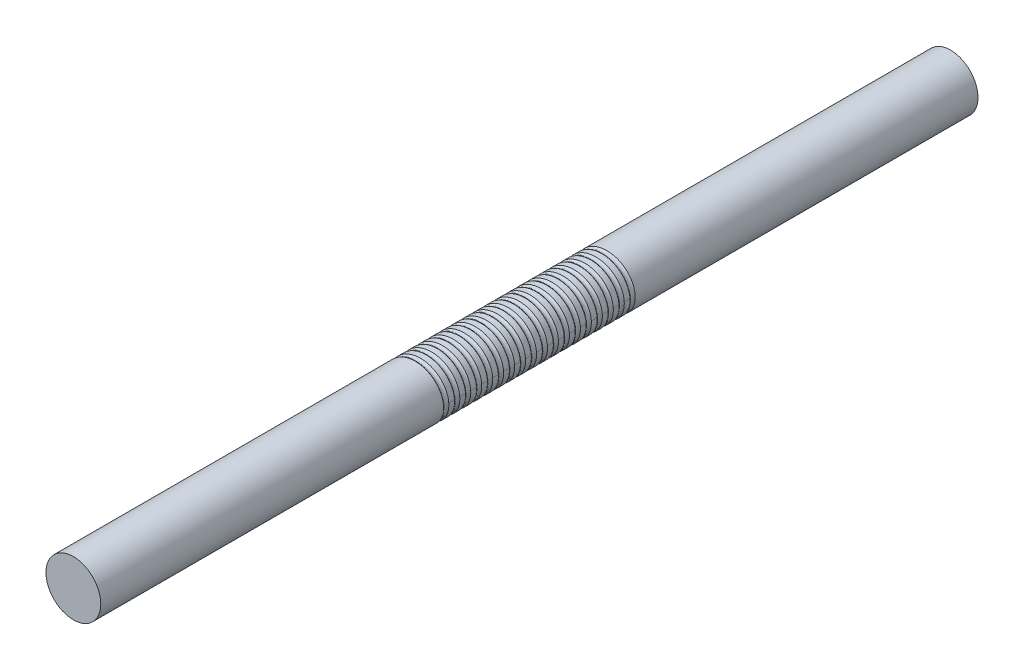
SolidWorks part; units mm, degrees
ref_plane "Front Plane" through (0, 0, 0) normal (0, 0, 1) x (1, 0, 0)
ref_plane "Top Plane" through (0, 0, 0) normal (0, 1, 0) x (1, 0, 0)
ref_plane "Right Plane" through (0, 0, 0) normal (1, 0, 0) x (0, 0, -1)
sketch "Sketch1" plane through (0, 0, 0) normal (0, 0, 1) x (1, 0, 0)
  circle A0 centre (0, 0) radius 25
  dimension "D1" = 50
extrude "Boss-Extrude1" add sketch "Sketch1" along normal blind 800
ref_plane "Plane1" through (0, 0, 310) normal (0, 0, 1) x (1, 0, 0)
sketch "Sketch2" plane through (0, 0, 310) normal (0, 0, 1) x (1, 0, 0)
  circle A0 centre (0, 0) radius 27.1167
  dimension "D1" = 54.2333
curve "Helix/Spiral1"
sketch "Sketch3" plane through (0, 0, 0) normal (0, 1, 0) x (1, 0, 0)
  circle A0 centre (-27.1167, -310) radius 3.175
  spline S0 degree 3 number of poles 418 (-27.1167, -310) -> (-27.1167, -490) construction
  dimension "D1" = 6.35
sweep "Cut-Sweep1" cut profiles "Sketch3" path "Helix/Spiral1"
pattern_linear "LPattern1" [suppressed] count 2 spacing 500
